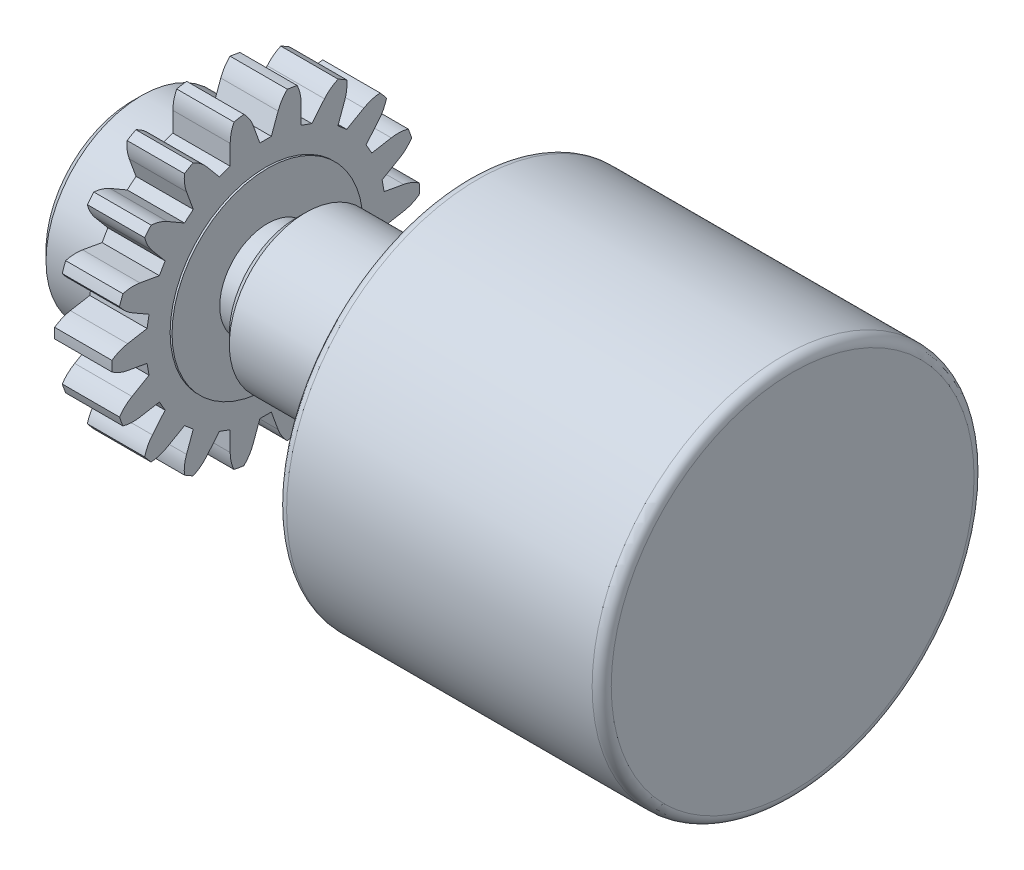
SolidWorks part; units mm, degrees
ref_plane "Plan de face" through (0, 0, 0) normal (0, 0, 1) x (1, 0, 0)
ref_plane "Plan de dessus" through (0, 0, 0) normal (0, 1, 0) x (1, 0, 0)
ref_plane "Plan de droite" through (0, 0, 0) normal (1, 0, 0) x (0, 0, -1)
sketch "Esquisse1" plane through (0, 0, 0) normal (0, 0, 1) x (1, 0, 0)
  line L0 (-19.4483, 0) -> (45.9971, 0) construction
  line L1 (0, 5) -> (-4, 5)
  line L2 (-4, 5) -> (-4, 0)
  line L3 (0, 5) -> (0, 8.05)
  line L4 (0, 8.05) -> (3, 8.05)
  line L5 (3, 5) -> (3, 8.05)
  line L6 (3, 5) -> (3.1, 5)
  line L7 (3.1, 0) -> (-4, 0)
  line L9 (3.1, 5) -> (3.1, 0)
  dimension "D1" = 5
  dimension "D2" = 3
  dimension "D3" = 0.1
  dimension "D4" = 8.05
  dimension "D5" = 4
revolve "Révolution1" add sketch "Esquisse1" angle 360 about L0
sketch "Esquisse2" plane through (0, 0, 0) normal (-1, 0, 0) x (0, 0, 1)
  line L0 (0, 17.9781) -> (0, -0.7899) construction
  line L1 (-2.3452, 8.5275) -> (1.3855, 8.1748)
  line L2 (0.6532, 7.2205) -> (0.3, 6.25)
  line L3 (0.3, 6.25) -> (-0.3009, 6.25)
  line L4 (-0.3009, 6.25) -> (-0.6541, 7.2204)
  arc A0 (-0.6541, 7.2204) -> (-2.3452, 8.5275) centre (-2.5334, 6.5364) ccw
  circle A1 centre (0, 0) radius 7.25 construction
  arc A2 (1.3855, 8.1748) -> (0.6532, 7.2205) centre (2.5326, 6.5365) ccw
  dimension "D6" = 14.5
  dimension "D3" = 4
  dimension "D1" = 70
  dimension "D2" = 70
  dimension "D5" = 0.3
extrude "Enlèv. mat.-Extru.1" cut sketch "Esquisse2" against normal through all
pattern_circular "Répétition circulaire1" count 18 over 360 about axis through (0, 0, 0) along (1, 0, 0) of "Enlèv. mat.-Extru.1"
sketch "Esquisse3" plane through (0, 0, 0) normal (0, 1, 0) x (1, 0, 0)
  line L0 (3.1, 0) -> (3, 0) construction
  circle A0 centre (12, 0) radius 1.5
  dimension "D1" = 3
  dimension "D2" = 12
extrude "Enlèv. mat.-Extru.2" [suppressed] cut sketch "Esquisse3" along normal blind 20
sketch "Esquisse4" plane through (3.1, 0, 0) normal (1, 0, 0) x (0, 0, -1)
  circle A0 centre (0, 0) radius 2.5
  dimension "D1" = 5
extrude "Boss.-Extru.1" add sketch "Esquisse4" along normal blind 1.5
sketch "Esquisse5" plane through (4.6, 0, 0) normal (1, 0, 0) x (0, 0, -1)
  circle A0 centre (0, 0) radius 4
  dimension "D1" = 8
extrude "Boss.-Extru.2" add sketch "Esquisse5" along normal blind 9
sketch "Esquisse6" plane through (13.6, 0, 0) normal (1, 0, 0) x (0, 0, -1)
  circle A0 centre (0, 0) radius 10
  dimension "D1" = 20
extrude "Boss.-Extru.3" add sketch "Esquisse6" along normal blind 17
chamfer "Chanfrein2" distance 0.5 angle 45 1 edges at (4.6, 0, -4)
fillet "Congé1" radius 0.5 2 edges at (13.6, 0, -10) (30.6, 0, -10)
chamfer "Chanfrein3" distance 0.5 angle 45 1 edges at (-4, 0, 5)
sketch "Esquisse7" plane through (13.6, 0, 0) normal (-1, 0, 0) x (0, 0, 1)
  circle A0 centre (0, 0) radius 4 construction
  circle A1 centre (0, 0) radius 4
extrude "Extru.-Mince1" add sketch "Esquisse7" along normal blind 0.5 separate body thin
